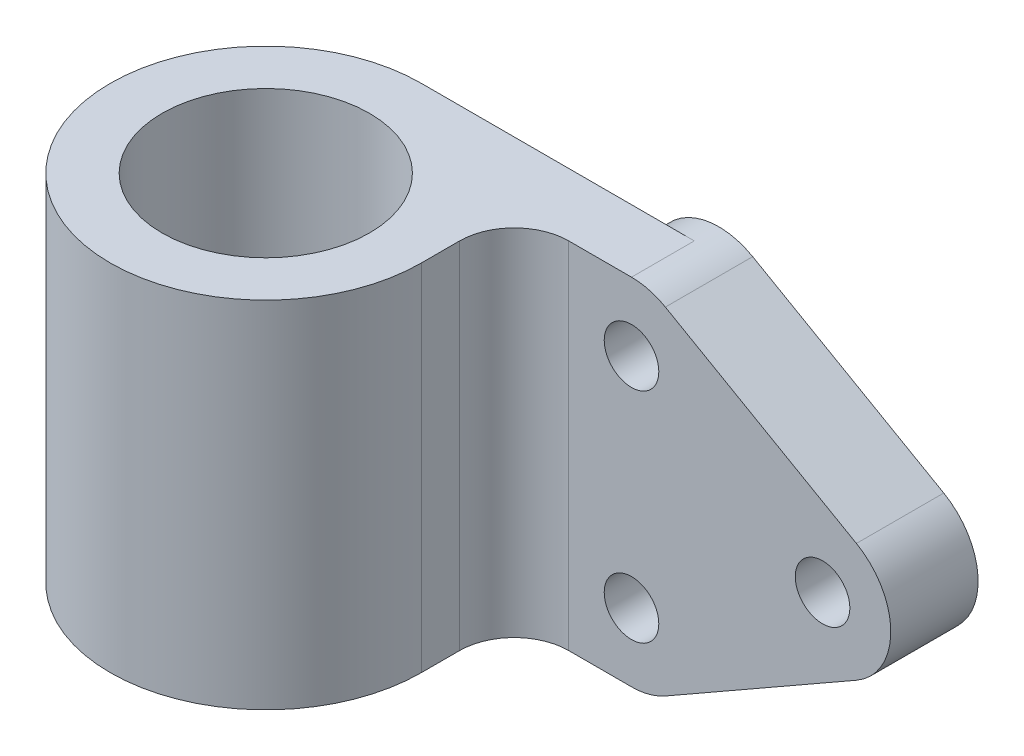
SolidWorks part; units mm, degrees
ref_plane "Front Plane" through (0, 0, 0) normal (0, 0, 1) x (1, 0, 0)
ref_plane "Top Plane" through (0, 0, 0) normal (0, 1, 0) x (1, 0, 0)
ref_plane "Right Plane" through (0, 0, 0) normal (1, 0, 0) x (0, 0, -1)
sketch "Sketch2" plane through (0, 0, 0) normal (0, 0, 1) x (1, 0, 0)
  line L0 (-47.5, 20) -> (-47.5, -20)
  line L1 (-28.7983, -30.853) -> (6.2017, -10.853)
  line L2 (6.2017, 10.853) -> (-28.7983, 30.853)
  arc A0 (-47.5, -20) -> (-28.7983, -30.853) centre (-35, -20) ccw
  arc A1 (6.2017, -10.853) -> (6.2017, 10.853) centre (0, 0) ccw
  arc A2 (-28.7983, 30.853) -> (-47.5, 20) centre (-35, 20) ccw
  dimension "D1" = 12.5
  dimension "D2" = 40
  dimension "D3" = 20
  dimension "D4" = 35
extrude "Boss-Extrude1" add sketch "Sketch2" along normal mid plane 16
sketch "Sketch3" plane through (0, 0, 0) normal (0, 1, 0) x (1, 0, 0)
  line L0 (-56.5, -25) -> (-56.5, -18)
  line L1 (12.5, 8) -> (6.2017, 8) construction
  line L2 (-85, 3.5) -> (-35, 3.5)
  line L3 (-35, 3.5) -> (-35, -8)
  line L4 (-47.5, -8) -> (-28.7983, -8) construction
  line L5 (-35, -8) -> (-46.5, -8)
  line L6 (-35, -8) -> (-35, 8) construction
  circle A0 centre (-85, -25) radius 19
  arc A1 (-85, 3.5) -> (-56.5, -25) centre (-85, -25) ccw
  arc A2 (-46.5, -8) -> (-56.5, -18) centre (-46.5, -18) ccw
  dimension "D1" = 38
  dimension "D2" = 57
  dimension "D4" = 10
  dimension "D5" = 33
  dimension "D6" = 50
extrude "Boss-Extrude2" add sketch "Sketch3" along normal mid plane 65
hole_wizard "Ø10.0 (10) Diameter Hole1" positions "Sketch6" profile "Sketch5" hole size "Ø10.0" standard "ANSI Metric"
sketch "Sketch6" plane through (0, 0, -8) normal (0, 0, -1) x (-1, 0, 0)
  arc A0 (28.7983, -30.853) -> (47.5, -20) centre (35, -20) ccw construction
  arc A1 (47.5, 20) -> (28.7983, 30.853) centre (35, 20) ccw construction
  arc A2 (-6.2017, 10.853) -> (-6.2017, -10.853) centre (0, 0) ccw construction
  point P0 (0, 0)
  point P3 (35, 20)
  point P5 (35, -20)
  point P8 (0, 0)
  point P11 (35, -20)
sketch "Sketch5" plane through (0, 0, -8) normal (1, 0, 0) x (0, 1, 0)
  line L0 (0, 0) -> (0, 61.5)
  line L1 (0, 61.5) -> (5, 61.5)
  line L2 (5, 61.5) -> (5, 0)
  line L5 (5, 0) -> (0, 0)
  line L11 (0, -6.35) -> (0, 107.95) construction
  dimension "Thru Hole Dia." = 10
  dimension "Thru Hole Depth" = 61.5
